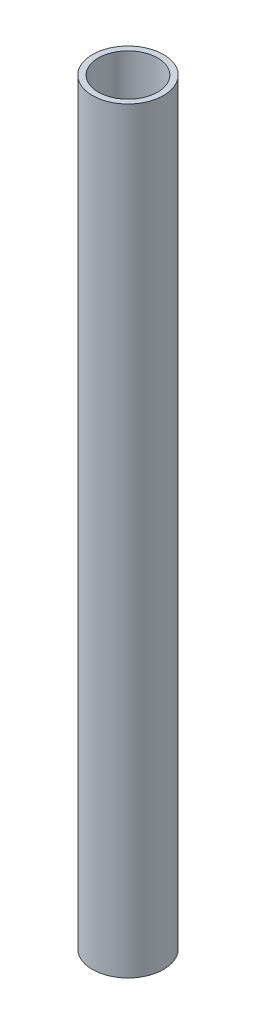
SolidWorks part; units mm, degrees
ref_plane "Front Plane" through (0, 0, 0) normal (0, 0, 1) x (1, 0, 0)
ref_plane "Top Plane" through (0, 0, 0) normal (0, 1, 0) x (1, 0, 0)
ref_plane "Right Plane" through (0, 0, 0) normal (1, 0, 0) x (0, 0, -1)
sketch "Sketch1" plane through (0, 0, 0) normal (0, 1, 0) x (1, 0, 0)
  circle A0 centre (0, 0) radius 16.7005
  circle A1 centre (0, 0) radius 13.9319
  dimension "D1" = 27.8638
  dimension "D2" = 33.401
extrude "Extrude1" add sketch "Sketch1" along normal blind 355.6
